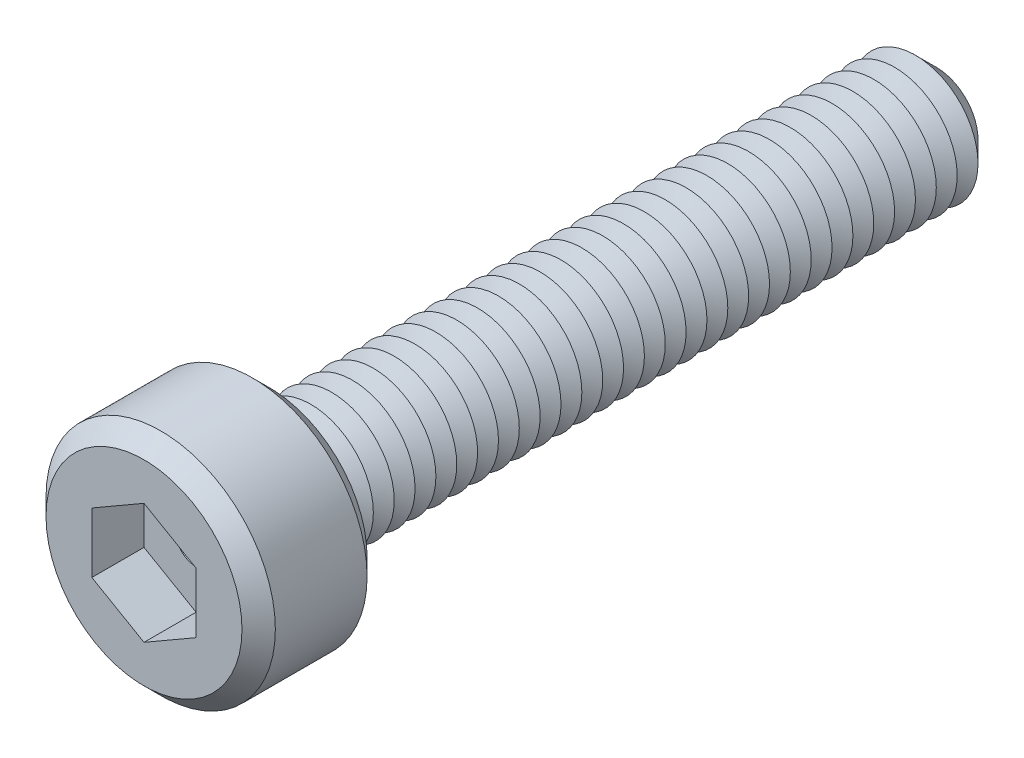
SolidWorks part; units mm, degrees
ref_plane "Front Plane" through (0, 0, 0) normal (0, 0, 1) x (1, 0, 0)
ref_plane "Top Plane" through (0, 0, 0) normal (0, 1, 0) x (1, 0, 0)
ref_plane "Right Plane" through (0, 0, 0) normal (1, 0, 0) x (0, 0, -1)
sketch "Sketch1" plane through (0, 0, 0) normal (0, 0, 1) x (1, 0, 0)
  circle A0 centre (0, 0) radius 2.75
  dimension "D1" = 5.5
extrude "Boss-Extrude1" add sketch "Sketch1" along normal blind 3
sketch "Sketch2" plane through (0, 0, 0) normal (0, 0, -1) x (-1, 0, 0)
  circle A0 centre (0, 0) radius 1.5
  dimension "D1" = 3
extrude "Boss-Extrude2" add sketch "Sketch2" along normal blind 16
chamfer "Chamfer1" distance 0.5 angle 45 1 edges at (-1.5, 0, -16)
sketch "Sketch3" plane through (0, 0, 0) normal (1, 0, 0) x (0, 0, -1)
  line L0 (-2.5121, 0) -> (4.5776, 0) construction
sketch "Sketch4" plane through (0, 0, 0) normal (1, 0, 0) x (0, 0, -1)
  line L0 (0, 1.5) -> (0.25, 1.067)
  line L1 (0.25, 1.067) -> (0.5, 1.5)
  line L2 (15.5, 1.5) -> (0, 1.5) construction
  line L3 (0.5, 1.5) -> (0, 1.5)
  dimension "D1" = 0.5
revolve "Cut-Revolve1" cut sketch "Sketch4" angle 360 about L0
pattern_linear "LPattern1" count 31 spacing 0.5 along (0, 0, -1) of "Cut-Revolve1"
sketch "Sketch5" plane through (0, 0, 3) normal (0, 0, 1) x (1, 0, 0)
  line L1 (0, 1.4434) -> (-1.25, 0.7217)
  line L2 (-1.25, 0.7217) -> (-1.25, -0.7217)
  line L3 (-1.25, -0.7217) -> (0, -1.4434)
  line L4 (0, -1.4434) -> (1.25, -0.7217)
  line L5 (1.25, -0.7217) -> (1.25, 0.7217)
  line L6 (1.25, 0.7217) -> (0, 1.4434)
  circle A0 centre (0, 0) radius 1.25 construction
  dimension "D1" = 2.5
extrude "Cut-Extrude1" cut sketch "Sketch5" against normal blind 1.25
sketch "Sketch6" plane through (0, 0, 1.75) normal (0, 0, 1) x (1, 0, 0)
  circle A0 centre (0, 0) radius 0.5
  dimension "D1" = 1
extrude "Cut-Extrude2" cut sketch "Sketch6" against normal up to surface (17.75 mm away)
chamfer "Chamfer2" distance 0.4 angle 45 2 edges at (2.75, 0, 0) (2.75, 0, 3)
